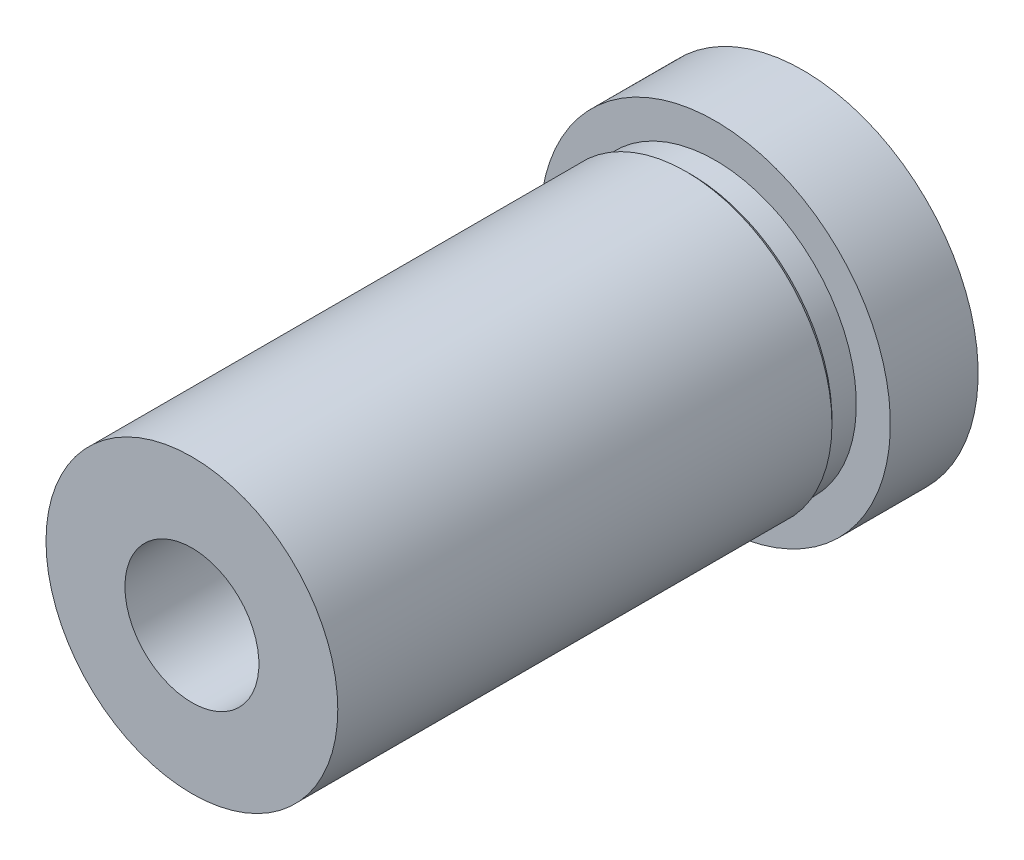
SolidWorks part; units mm, degrees
ref_plane "Front" through (0, 0, 0) normal (0, 0, 1) x (1, 0, 0)
ref_plane "Top" through (0, 0, 0) normal (0, 1, 0) x (1, 0, 0)
ref_plane "Right" through (0, 0, 0) normal (1, 0, 0) x (0, 0, -1)
sketch "Logo3_Revol_Axis" plane through (0, 0, 0) normal (0, 1, 0) x (1, 0, 0)
  line L0 (0, -30.1653) -> (0, 30.1653) construction
sketch "Logo3_bib1" plane through (0, 0, 0) normal (0, -1, 0) x (-1, 0, 0)
  line L1 (3.6449, -28.4747) -> (7.9375, -28.4747)
  line L2 (7.9375, -28.4747) -> (7.9375, -1.5917)
  line L4 (7.6729, 0) -> (7.6729, -1.3271)
  line L5 (7.6729, 0) -> (9.525, 0)
  line L6 (9.525, 0) -> (9.525, 4.7752)
  line L7 (3.7895, 4.7752) -> (3.6449, -25.2997)
  line L8 (3.6449, -25.2997) -> (3.6449, -28.4747)
  line L9 (9.525, 4.7752) -> (3.7895, 4.7752)
  line L10 (0, 19.4323) -> (0, -23.9633) construction
  line L11 (7.9375, -1.5917) -> (7.6729, -1.3271)
  point P11 (3.7895, 4.7752)
revolve "Revolve1" add sketch "Logo3_bib1" angle 360 about L10
other "DeleteFace1"
equation "\"prof_rainure@Logo3_bib1\" = (\"logo3_d4@Logo3_bib1\"-\"logo3_d3@Logo3_bib1\")/12"
